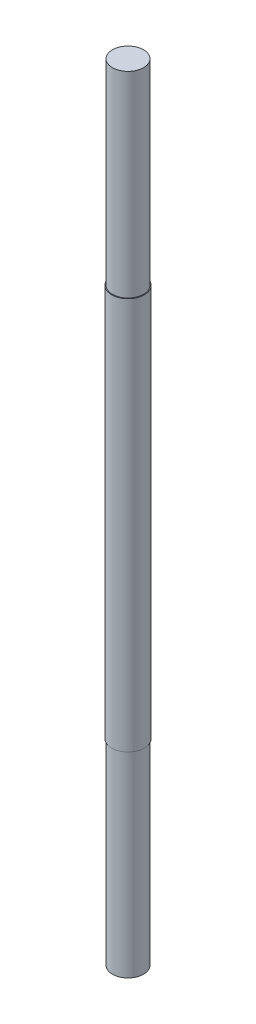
SolidWorks part; units mm, degrees
ref_plane "Front Plane" through (0, 0, 0) normal (0, 0, 1) x (1, 0, 0)
ref_plane "Top Plane" through (0, 0, 0) normal (0, 1, 0) x (1, 0, 0)
ref_plane "Right Plane" through (0, 0, 0) normal (1, 0, 0) x (0, 0, -1)
sketch "Sketch1" plane through (0, 0, 0) normal (0, 1, 0) x (1, 0, 0)
  circle A0 centre (0, 0) radius 6.35
  dimension "D1" = 12.7
extrude "Boss-Extrude1" add sketch "Sketch1" along normal mid plane 304.8
sketch "Sketch2" plane through (0, 152.4, 0) normal (0, 1, 0) x (1, 0, 0)
  circle A0 centre (0, 0) radius 6.0325
  circle A1 centre (0, 0) radius 12.7
  dimension "D1" = 12.065
sketch "Sketch3" plane through (0, -152.4, 0) normal (0, -1, 0) x (1, 0, 0)
  circle A0 centre (0, 0) radius 6.0325
  circle A1 centre (0, 0) radius 12.7
  circle A2 centre (0, 0) radius 6.0325 construction
  circle A3 centre (0, 0) radius 12.7 construction
extrude "threads a" cut sketch "Sketch2" against normal blind 76.2
extrude "threads b" cut sketch "Sketch3" against normal blind 76.2
